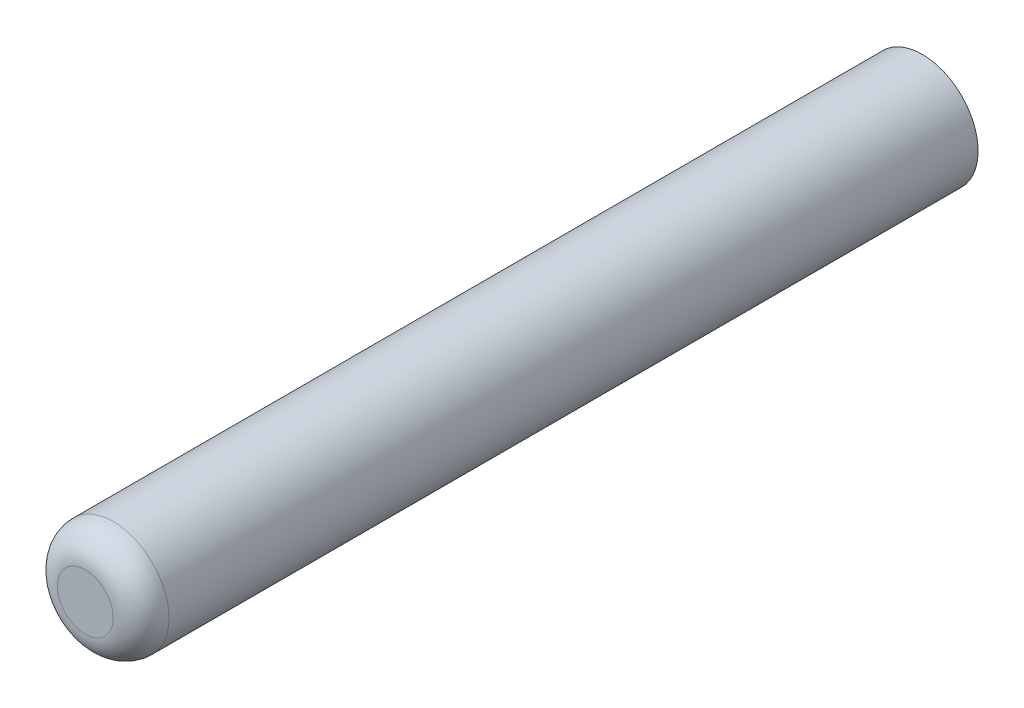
SolidWorks part; units mm, degrees
ref_plane "Face" through (0, 0, 0) normal (0, 0, 1) x (1, 0, 0)
ref_plane "Dessus" through (0, 0, 0) normal (0, 1, 0) x (1, 0, 0)
ref_plane "Droite" through (0, 0, 0) normal (1, 0, 0) x (0, 0, -1)
sketch "Esquisse1" plane through (0, 0, 0) normal (0, 0, 1) x (1, 0, 0)
  circle A0 centre (0, 0) radius 1
  dimension "D1" = 2
extrude "Cylindre de base" add sketch "Esquisse1" along normal mid plane 15
fillet "Congé" radius 0.5
